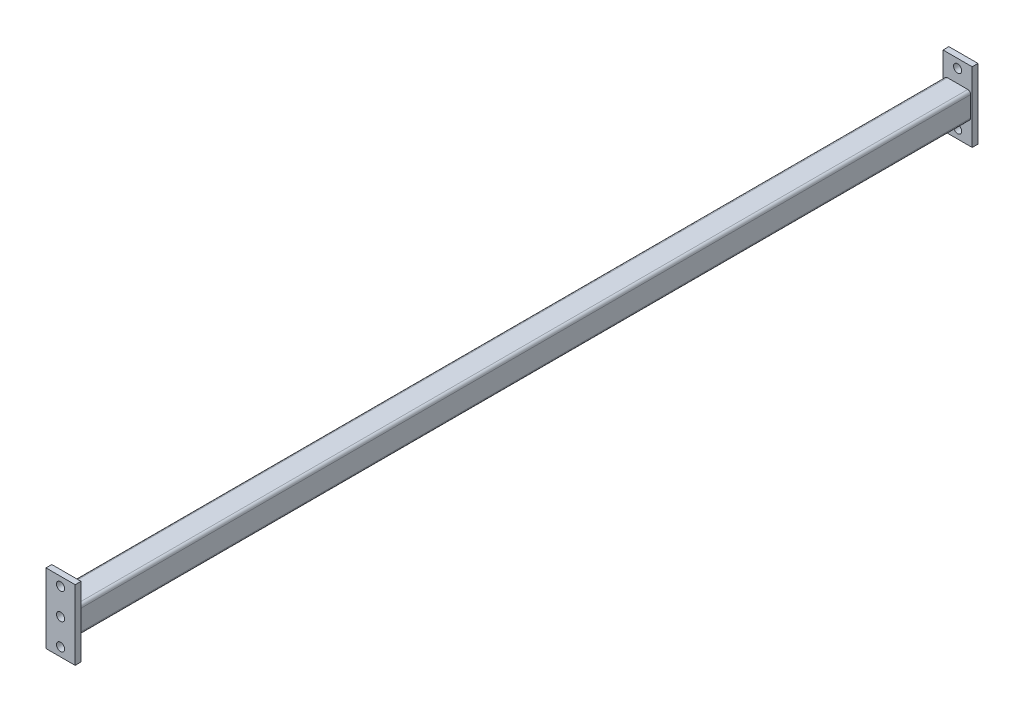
SolidWorks part; units mm, degrees
ref_plane "Front" through (0, 0, 0) normal (0, 0, 1) x (1, 0, 0)
ref_plane "Top" through (0, 0, 0) normal (0, 1, 0) x (1, 0, 0)
ref_plane "Right" through (0, 0, 0) normal (1, 0, 0) x (0, 0, -1)
sketch "Esquisse1" plane through (0, 0, 0) normal (0, 0, 1) x (1, 0, 0)
  line L1 (-25, 60) -> (25, 60)
  line L2 (-25, 60) -> (-25, -60)
  line L3 (-25, -60) -> (25, -60)
  line L4 (25, 60) -> (25, -60)
  circle A0 centre (0, 45) radius 7
  circle A1 centre (0, 0) radius 7
  circle A2 centre (0, -45) radius 7
  dimension "D5" = 14
  dimension "D6" = 14
  dimension "D7" = 14
  dimension "D1" = 50
  dimension "D2" = 120
  dimension "D3" = 60
  dimension "D8" = 15
  dimension "D10" = 90
  dimension "D11" = 25
extrude "Base-Extrusion" add sketch "Esquisse1" along normal blind 10
sketch "Esquisse3" plane through (0, 0, 10) normal (0, 0, 1) x (1, 0, 0)
  line L1 (-17.5, 22.5) -> (17.5, 22.5)
  line L2 (-22.5, 17.5) -> (-22.5, -17.5)
  line L3 (-17.5, -22.5) -> (17.5, -22.5)
  line L4 (22.5, 17.5) -> (22.5, -17.5)
  line L5 (-19.5, 19.5) -> (19.5, 19.5)
  line L6 (-19.5, 19.5) -> (-19.5, -19.5)
  line L7 (-19.5, -19.5) -> (19.5, -19.5)
  line L8 (19.5, 19.5) -> (19.5, -19.5)
  arc A0 (-22.5, 17.5) -> (-17.5, 22.5) centre (-17.5, 17.5) cw
  arc A1 (-17.5, -22.5) -> (-22.5, -17.5) centre (-17.5, -17.5) cw
  arc A2 (22.5, -17.5) -> (17.5, -22.5) centre (17.5, -17.5) cw
  arc A3 (17.5, 22.5) -> (22.5, 17.5) centre (17.5, 17.5) cw
  point P11 (-22.5, 22.5)
  point P14 (-22.5, -22.5)
  point P19 (22.5, 22.5)
  dimension "D9" = 5
  dimension "D1" = 45
  dimension "D2" = 22.5
  dimension "D3" = 45
  dimension "D4" = 22.5
  dimension "D5" = 3
  dimension "D6" = 3
  dimension "D7" = 3
  dimension "D8" = 3
extrude "Boss.-Extru.1" add sketch "Esquisse3" along normal blind 1530
sketch "Esquisse4" plane through (0, 0, 1540) normal (0, 0, 1) x (1, 0, 0)
  line L1 (-25, 60) -> (25, 60)
  line L2 (-25, 60) -> (-25, -60)
  line L3 (-25, -60) -> (25, -60)
  line L4 (25, 60) -> (25, -60)
  circle A0 centre (0, 0) radius 7
  circle A1 centre (0, 45) radius 7
  circle A2 centre (0, -45) radius 7
  dimension "D1" = 14
  dimension "D2" = 14
  dimension "D3" = 14
  dimension "D4" = 90
  dimension "D5" = 15
  dimension "D6" = 25
  dimension "D7" = 25
extrude "Boss.-Extru.2" add sketch "Esquisse4" along normal blind 10
